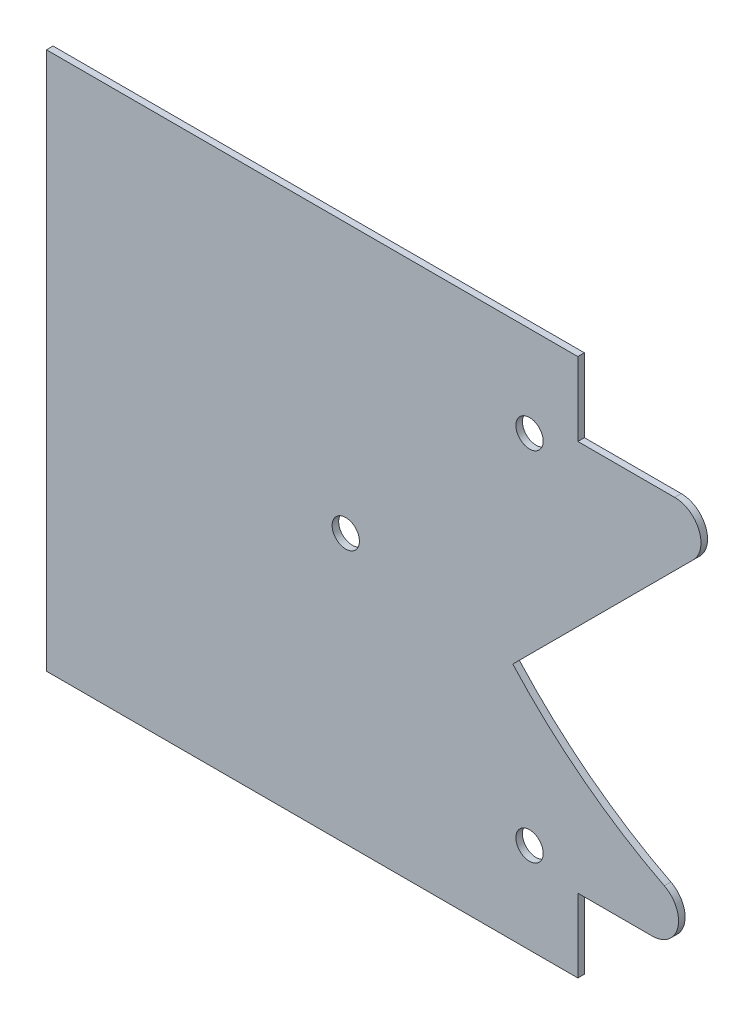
SolidWorks part; units mm, degrees
ref_plane "Front Plane" through (0, 0, 0) normal (0, 0, 1) x (1, 0, 0)
ref_plane "Top Plane" through (0, 0, 0) normal (0, 1, 0) x (1, 0, 0)
ref_plane "Right Plane" through (0, 0, 0) normal (1, 0, 0) x (0, 0, -1)
sketch "Sketch1" plane through (0, 0, 0) normal (0, 0, 1) x (1, 0, 0)
  line L0 (0, 28.4797) -> (0, 32.5438) construction
  line L1 (29.21, -28.4797) -> (-29.21, -28.4797) construction
  line L2 (29.21, -28.4797) -> (29.21, 28.4798) construction
  line L3 (29.21, 28.4798) -> (-29.21, 28.4797) construction
  line L4 (-29.21, -28.4797) -> (-29.21, 28.4797) construction
  line L5 (29.21, -28.4797) -> (-29.21, 28.4797) construction
  line L6 (29.21, 28.4798) -> (-29.21, -28.4797) construction
  line L7 (48.895, 32.5437) -> (-104.14, 32.5438)
  line L8 (48.895, 32.5437) -> (48.895, -32.5437)
  line L9 (48.895, -32.5437) -> (-104.14, -32.5438)
  line L10 (-104.14, 32.5438) -> (-104.14, -32.5438)
  line L11 (0, -28.4797) -> (0, -32.5438) construction
  line L12 (-39.37, 0) -> (39.37, 0) construction
  line L13 (-39.37, 32.5437) -> (-39.37, 71.9137) construction
  line L14 (-39.37, 71.9137) -> (-78.74, 32.5437) construction
  line L15 (39.37, 0) -> (48.895, 0) construction
  line L16 (44.1325, 0) -> (44.1325, 22.225) construction
  line L17 (44.1325, 0) -> (44.1325, -22.225) construction
  line L18 (-39.37, 0) -> (-45.72, 0) construction
  line L19 (-45.72, 21.59) -> (-45.72, -21.59) construction
  circle A0 centre (0, 0) radius 24.765
  circle A1 centre (29.21, 28.4798) radius 1.651
  circle A2 centre (-29.21, 28.4797) radius 1.651
  circle A3 centre (-29.21, -28.4797) radius 1.651
  circle A4 centre (29.21, -28.4797) radius 1.651
  circle A5 centre (44.1325, 22.225) radius 1.651
  circle A6 centre (44.1325, -22.225) radius 1.651
  circle A7 centre (-45.72, 21.59) radius 1.651
  circle A8 centre (-45.72, -21.59) radius 1.651
  dimension "D1" = 49.53
  dimension "D2" = 3.302
  dimension "D12" = 3.302
  dimension "D15" = 3.302
  dimension "D3" = 4.064
  dimension "D4" = 65.0875
  dimension "D5" = 78.74
  dimension "D6" = 58.42
  dimension "D7" = 9.525
  dimension "D8" = 45
  dimension "D9" = 39.37
  dimension "D10" = 25.4
  dimension "D11" = 44.45
  dimension "D13" = 43.18
  dimension "D14" = 6.35
extrude "Boss-Extrude1" add sketch "Sketch1" along normal blind 0.7937
sketch "Internal Copper" plane through (0, 0, 0) normal (0, 0, 1) x (1, 0, 0)
  line L0 (48.895, 32.5437) -> (-104.14, 32.5438) construction
  line L1 (-42.8625, 32.5437) -> (42.8625, 32.5437) construction
  line L2 (-42.8625, 32.5437) -> (-42.8625, 27.3368) construction
  line L3 (-39.6875, 24.1617) -> (39.6875, 24.1617) construction
  line L4 (42.8625, 32.5437) -> (42.8625, 27.3368) construction
  line L5 (-104.14, -32.5438) -> (48.895, -32.5437) construction
  line L6 (42.8625, -32.5438) -> (42.8625, -27.3368) construction
  line L7 (-39.6875, -24.1618) -> (39.6875, -24.1618) construction
  line L8 (-42.8625, -32.5438) -> (-42.8625, -27.3368) construction
  line L9 (-42.8625, -32.5438) -> (42.8625, -32.5438) construction
  arc A0 (42.8625, 27.3368) -> (39.6875, 24.1617) centre (39.6875, 27.3368) cw construction
  arc A1 (-39.6875, 24.1617) -> (-42.8625, 27.3368) centre (-39.6875, 27.3368) cw construction
  arc A2 (-39.6875, -24.1618) -> (-42.8625, -27.3368) centre (-39.6875, -27.3368) ccw construction
  arc A3 (42.8625, -27.3368) -> (39.6875, -24.1618) centre (39.6875, -27.3368) ccw construction
  point P6 (0, 32.5437)
  point P17 (-42.8625, 24.1617)
  point P27 (0, -32.5438)
  dimension "D3" = 3.175
  dimension "D1" = 8.382
  dimension "D2" = 79.375
sketch "External Copper" plane through (0, 0, 0) normal (0, 0, 1) x (1, 0, 0)
  line L0 (-40.005, 32.5437) -> (-40.005, -32.5438) construction
  line L1 (48.895, 32.5437) -> (-104.14, 32.5438) construction
  line L2 (-104.14, -32.5438) -> (48.895, -32.5437) construction
  circle A0 centre (-29.21, 28.4797) radius 1.651 construction
  dimension "D1" = 10.795
sketch "Sketch2" plane through (0, 0, 0.7937) normal (0, 0, 1) x (1, 0, 0)
  line L0 (0, 39.6557) -> (-45.5523, -5.8966) construction
  line L1 (0, 39.6557) -> (0, 0) construction
  line L2 (0, 39.6557) -> (64.4207, 39.6557)
  line L3 (0, 39.6557) -> (-4.4901, 39.6557)
  line L4 (-4.4901, 39.6557) -> (-47.7421, -3.5962)
  arc A0 (-45.5523, -5.8966) -> (64.4207, 39.6557) centre (0, 39.6557) ccw
  circle A1 centre (0, 0) radius 24.765 construction
  arc A2 (-45.5523, -5.8966) -> (-47.7421, -3.5962) centre (0, 39.6557) cw
  dimension "D1" = 45
  dimension "D2" = 39.6557
  dimension "D3" = 3.175
extrude "Cut-Extrude2" cut sketch "Sketch2" against normal through all
fillet "Fillet1" radius 2.54 2 edges at (48.895, -2.2884, 0.3969) (-11.6021, 32.5438, 0.3969)
sketch "Sketch4" plane through (0, 0, 0) normal (0, 0, 1) x (1, 0, 0)
  line L0 (-17.7342, 32.5438) -> (-104.14, 32.5438) construction
  line L1 (-39.878, 32.5438) -> (48.895, 32.5438)
  line L2 (-39.878, 32.5438) -> (-39.878, -32.5438)
  line L3 (-39.878, -32.5438) -> (48.895, -32.5438)
  line L4 (48.895, 32.5438) -> (48.895, -32.5438)
  line L5 (-104.14, -32.5438) -> (48.895, -32.5437) construction
  line L6 (48.895, -32.5437) -> (48.895, -8.6656) construction
  line L7 (0, 0) -> (-67.945, 0) construction
  line L8 (-39.878, 23.6538) -> (0, 23.6538)
  line L10 (-39.878, -23.6538) -> (0, -23.6538)
  line L11 (0, 23.6538) -> (0, -23.6538)
  circle A0 centre (-67.945, 0) radius 1.651
  circle A1 centre (-45.72, 21.59) radius 1.651 construction
  dimension "D3" = 3.302
  dimension "D1" = 39.878
  dimension "D2" = 8.89
  dimension "D4" = 22.225
extrude "Cut-Extrude3" cut sketch "Sketch4" along normal through all
fillet "Fillet2" radius 3.175 2 edges at (-11.9139, -23.6538, 0.3969) (-20.4921, 23.6538, 0.3969)
